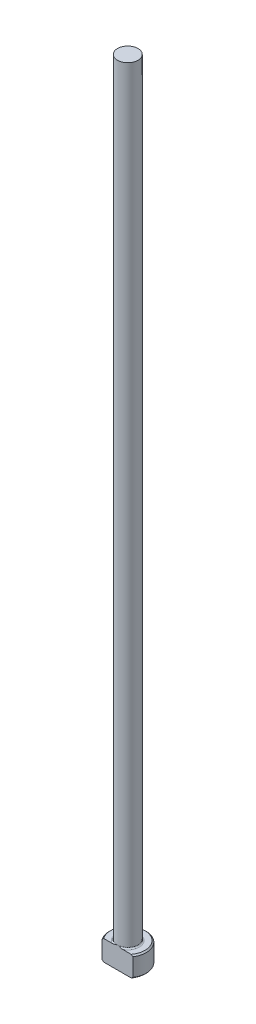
SolidWorks part; units mm, degrees
ref_plane "Front Plane" through (0, 0, 0) normal (0, 0, 1) x (1, 0, 0)
ref_plane "Top Plane" through (0, 0, 0) normal (0, 1, 0) x (1, 0, 0)
ref_plane "Right Plane" through (0, 0, 0) normal (1, 0, 0) x (0, 0, -1)
sketch "Sketch1" plane through (0, 0, 0) normal (0, 0, 1) x (1, 0, 0)
  line L0 (0, 259.9588) -> (0, -15.1925) construction
  line L1 (0, 0) -> (-3.5687, 0)
  line L2 (-3.5687, 0) -> (-3.5687, 3.9624)
  line L3 (-3.5687, 3.9624) -> (-1.9837, 3.9624)
  line L4 (-1.9837, 3.9624) -> (-1.9837, 152.4)
  line L5 (-1.9837, 152.4) -> (0, 152.4)
  line L6 (0, 152.4) -> (0, 0)
  dimension "L" = 152.4
  dimension "H" = 7.1374
  dimension "T" = 3.9624
  dimension "D" = 3.9675
revolve "Revolve1" add sketch "Sketch1" angle 360 about L0
chamfer "Chamfer1" distance 0.254 angle 45 2 edges at (0, 3.9624, 3.5687) (0, 0, 3.5687)
fillet "Fillet1" radius 0.254 1 edges at (0, 3.9624, 1.9837)
sketch "Sketch2" plane through (0, 0, 0) normal (0, 1, 0) x (1, 0, 0)
  line L0 (-2.9665, -1.9837) -> (2.9665, -1.9837)
  circle A0 centre (0, 0) radius 3.5687 construction
  arc A1 (-2.9665, -1.9837) -> (2.9665, -1.9837) centre (0, 0) ccw
  circle A3 centre (0, 0) radius 1.9837 construction
  dimension "D1" = 0
extrude "Key" cut sketch "Sketch2" along normal through all
sketch "Pocket Sketch" plane through (0, 0, 0) normal (0, 0, 1) x (1, 0, 0)
  line L0 (-3.9656, 0) -> (-3.9656, 3.9878)
  line L1 (-3.9656, 3.9878) -> (-2.9442, 3.9878)
  line L2 (-2.1822, 4.7498) -> (-2.1822, 22.225)
  line L3 (-2.1822, 22.225) -> (0, 22.225)
  line L4 (0, 22.225) -> (0, 0)
  line L5 (0, 0) -> (-3.9656, 0)
  line L6 (0, 12.6104) -> (0, -2.4989) construction
  line L7 (-3.5687, 3.7084) -> (-3.5687, 0.254) construction
  line L8 (3.3147, 3.9624) -> (-3.3147, 3.9624) construction
  line L9 (-1.9837, 152.4) -> (-1.9837, 4.2164) construction
  line L10 (-2.9442, 3.9878) -> (-2.1822, 4.7498)
  point P3 (-2.1822, 3.9878)
  dimension "D1" = 7.9311
  dimension "D2" = 0.3969
  dimension "D3" = 0.0254
  dimension "D4" = 0.1984
  dimension "D5" = 4.3644
  dimension "D6" = 22.225
